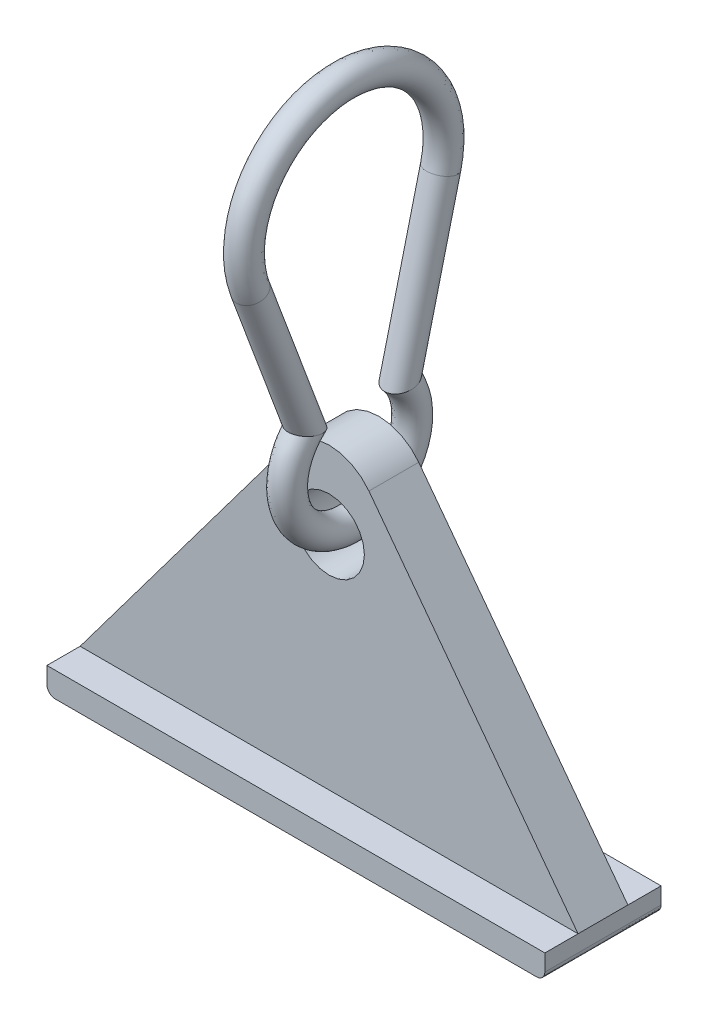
SolidWorks part; units mm, degrees
ref_plane "前视基准面" through (0, 0, 0) normal (0, 0, 1) x (1, 0, 0)
ref_plane "上视基准面" through (0, 0, 0) normal (0, 1, 0) x (1, 0, 0)
ref_plane "右视基准面" through (0, 0, 0) normal (1, 0, 0) x (0, 0, -1)
sketch "草图1" plane through (0, 0, 0) normal (0, 0, 1) x (1, 0, 0)
  line L2 (-30, 0) -> (0, 40)
  line L3 (0, 40) -> (30, 0)
  line L4 (-30, 0) -> (-30, -3)
  line L5 (-30, -3) -> (30, -3)
  line L6 (30, -3) -> (30, 0)
  circle A0 centre (0, 26.6667) radius 4.25
  dimension "D4" = 8.5
  dimension "D1" = 50
  dimension "D2" = 50
  dimension "D3" = 3
  dimension "D6" = 8
extrude "凸台-拉伸1" add sketch "草图1" along normal mid plane 14
fillet "圆角1" radius 6 1 edges at (0, 40, 0)
sketch "草图2" plane through (-30, 0, 0) normal (-1, 0, 0) x (0, 0, 1)
  line L0 (7, 0) -> (-7, 0) construction
  line L1 (-7, 36) -> (-3, 36)
  line L2 (-7, 36) -> (-7, 0)
  line L3 (-7, 0) -> (-3, 0)
  line L4 (-3, 36) -> (-3, 0)
  line L5 (0, 36) -> (0, 0) construction
  line L6 (7, 36) -> (-7, 36) construction
  line L7 (3, 36) -> (3, 0)
  line L8 (7, 0) -> (3, 0)
  line L9 (7, 36) -> (7, 0)
  line L10 (7, 36) -> (3, 36)
  dimension "D1" = 4
extrude "切除-拉伸1" cut sketch "草图2" against normal through all
fillet "圆角7" radius 1 1 edges at (-30, -3, 0)
fillet "圆角10" radius 1 1 edges at (30, -3, 0)
sketch "草图5" plane through (0, 0, 0) normal (0, 0, 1) x (1, 0, 0)
  circle A0 centre (0, 26.6667) radius 1.75
sketch "草图6" plane through (0, 0, 0) normal (1, 0, 0) x (0, 0, -1)
  line L0 (10.4157, 58.287) -> (5.5374, 38.6053)
  line L1 (-12.4723, 56.9726) -> (-5.9011, 39.3915)
  arc A0 (-5.9011, 39.3915) -> (5.5374, 38.6053) centre (-0.5134, 34.174) ccw
  arc A1 (10.4157, 58.287) -> (-12.4723, 56.9726) centre (-1.2318, 61.174) ccw
  dimension "D1" = 24
  dimension "D2" = 15
  dimension "D3" = 27
sweep "扫描1" add profiles "草图5" path "草图6"
